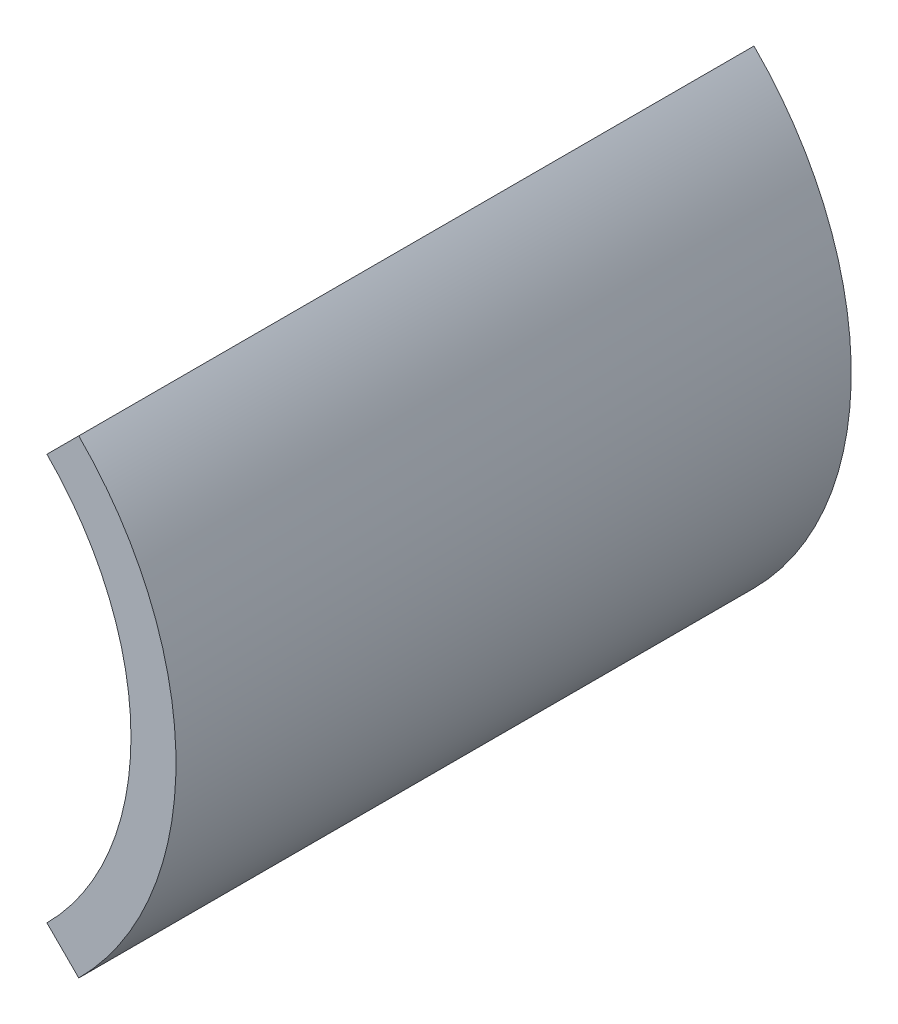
SolidWorks part; units mm, degrees
ref_plane "Front Plane" through (0, 0, 0) normal (0, 0, 1) x (1, 0, 0)
ref_plane "Top Plane" through (0, 0, 0) normal (0, 1, 0) x (1, 0, 0)
ref_plane "Right Plane" through (0, 0, 0) normal (1, 0, 0) x (0, 0, -1)
sketch "Sketch1" plane through (0, 0, 0) normal (0, 0, 1) x (1, 0, 0)
  line L0 (0, 0) -> (19.2185, 0) construction
  line L1 (9.0156, 9.0156) -> (10.4298, 10.4298)
  line L2 (9.0156, -9.0156) -> (10.4298, -10.4298)
  arc A0 (9.0156, -9.0156) -> (9.0156, 9.0156) centre (0, 0) ccw
  arc A1 (10.4298, -10.4298) -> (10.4298, 10.4298) centre (0, 0) ccw
  point P4 (0, 0)
  dimension "D1" = 29.5
  dimension "D2" = 25.5
  dimension "D3" = 90
extrude "Boss-Extrude1" add sketch "Sketch1" along normal mid plane 30
